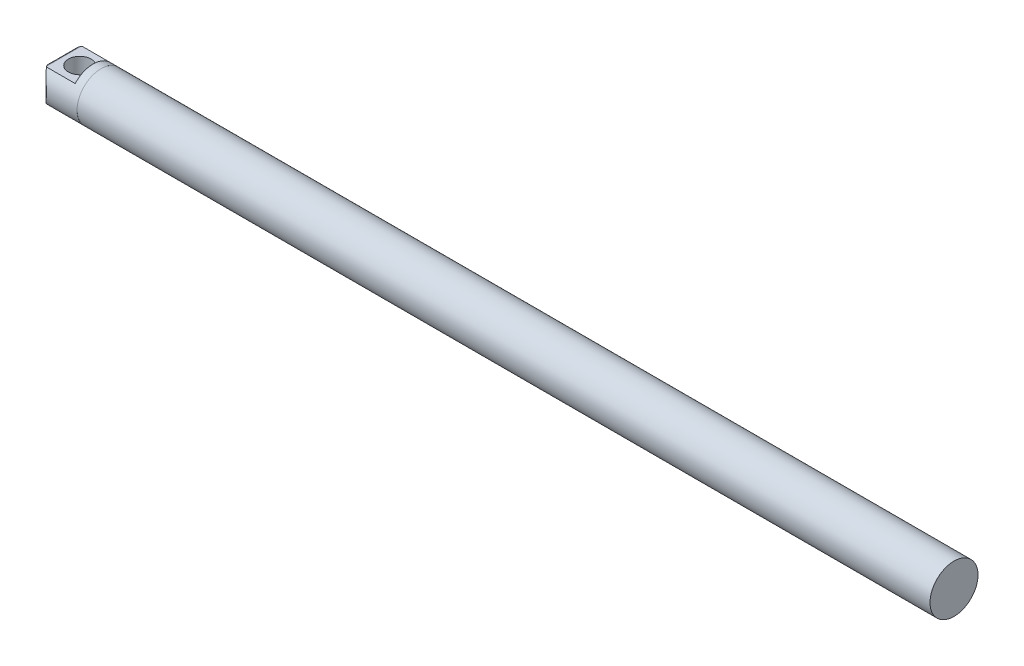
SolidWorks part; units mm, degrees
ref_plane "Front Plane" through (0, 0, 0) normal (0, 0, 1) x (1, 0, 0)
ref_plane "Top Plane" through (0, 0, 0) normal (0, 1, 0) x (1, 0, 0)
ref_plane "Right Plane" through (0, 0, 0) normal (1, 0, 0) x (0, 0, -1)
sketch "Sketch2" plane through (0, 0, 0) normal (1, 0, 0) x (0, 0, -1)
  circle A0 centre (0, 0) radius 4.5
  dimension "D1" = 9
extrude "Boss-Extrude1" add sketch "Sketch2" along normal blind 160
sketch "Sketch3" plane through (0, 0, 0) normal (-1, 0, 0) x (0, 0, 1)
  circle A1 centre (0, 0) radius 4.5
  circle A2 centre (0, 0) radius 4.5
  dimension "D1" = 0
extrude "Boss-Extrude2" add sketch "Sketch3" along normal blind 8 separate body
sketch "Sketch4" plane through (-8, 0, 0) normal (-1, 0, 0) x (0, 0, 1)
  line L1 (-3.3541, 3) -> (3.3541, 3)
  line L2 (-3.3541, 3) -> (-3.3541, -3)
  line L3 (-3.3541, -3) -> (3.3541, -3)
  line L4 (3.3541, 3) -> (3.3541, -3)
  line L5 (-3.3541, 3) -> (3.3541, -3) construction
  line L6 (-3.3541, -3) -> (3.3541, 3) construction
  circle A0 centre (0, 0) radius 4.5 construction
  circle A2 centre (0, 0) radius 4.5
  circle A3 centre (0, 0) radius 4.5
  point P0 (0, 0)
  dimension "D1" = 6
  dimension "D2" = 0
extrude "Cut-Extrude1" cut sketch "Sketch4" against normal offset from surface (6.5 mm away) 1.5 contours L1 M5 | L3 M5
sketch "Sketch5" plane through (0, -3, 0) normal (0, -1, 0) x (1, 0, 0)
  line L0 (0, 0) -> (-8, 0) construction
  line L1 (-8, -3.3541) -> (-8, 3.3541) construction
  circle A0 centre (-4, 0) radius 2.125
  dimension "D1" = 4.25
  dimension "D2" = 4
extrude "Cut-Extrude2" cut sketch "Sketch5" against normal through all
fillet "Fillet1" [suppressed] radius 1.5
sketch "Sketch6" plane through (0, -3, 0) normal (0, -1, 0) x (1, 0, 0)
  line L0 (-8, -4.5) -> (-3.5, -4.5) construction
  line L2 (-8, 0) -> (0, 0) construction
  line L4 (-8, -3.3541) -> (-8, 3.3541) construction
  line L5 (-8, 4.5) -> (-3.5, 4.5) construction
  line L6 (-3.5, -4.5) -> (-8, -4.5)
  line L7 (-8, -4.5) -> (-8, 4.5)
  line L8 (-8, 4.5) -> (-3.5, 4.5)
  line L9 (-1.5, 3.3541) -> (-8, 3.3541) construction
  arc A0 (-3.5, -4.5) -> (-3.5, 4.5) centre (-3.5, 0) cw
  point P1 (-6.5, 3.3541)
  dimension "D1" = 1.5
fillet "Fillet2" radius 1 1 edges at (-8, -3, 0)
fillet "Fillet3" radius 1 1 edges at (-8, 3, 0)
sketch "Sketch8" plane through (0, -3, 0) normal (0, -1, 0) x (1, 0, 0)
  line L0 (-8, 0) -> (0, 0) construction
  line L1 (-8, -4.5) -> (-8, 4.5) construction
  line L3 (-8, 4.5) -> (-3.5, 4.5) construction
  line L4 (-3.5, -4.5) -> (-8, -4.5) construction
  line L5 (-5.75, -4.5) -> (-8, -4.5)
  line L6 (-8, -4.5) -> (-8, 4.5)
  line L7 (-8, 4.5) -> (-5.75, 4.5)
  arc A0 (-5.75, -4.5) -> (-5.75, 4.5) centre (-2.375, 0) cw
  dimension "D1" = 2.25
extrude "Cut-Extrude5" cut sketch "Sketch8" against normal through all both and the other way through all
